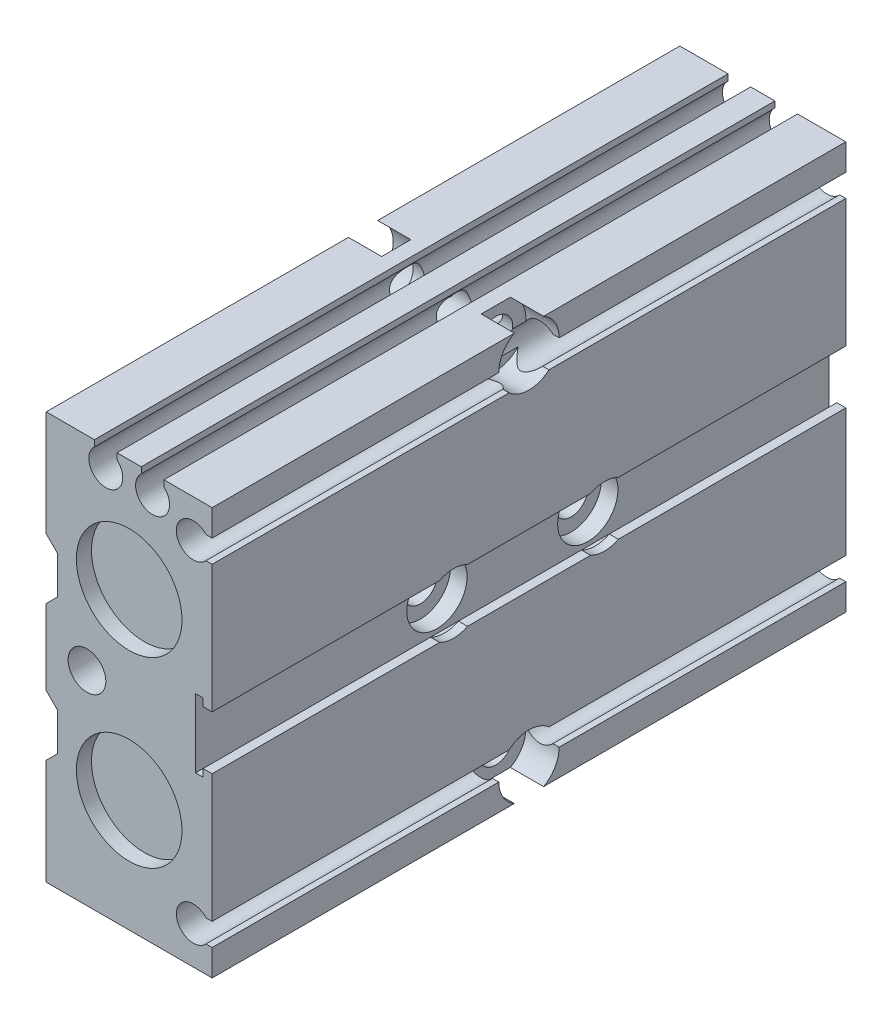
SolidWorks part; units mm, degrees
ref_plane "前视基准面" through (0, 0, 0) normal (0, 0, 1) x (1, 0, 0)
ref_plane "上视基准面" through (0, 0, 0) normal (0, 1, 0) x (1, 0, 0)
ref_plane "右视基准面" through (0, 0, 0) normal (1, 0, 0) x (0, 0, -1)
imported_body "输入1"
sketch "草图1" plane through (-11, 0, 0) normal (-1, 0, 0) x (0, 0, 1)
  line L1 (47, 27) -> (-3.9589, 27)
  line L2 (47, 27) -> (47, -28.3404)
  line L3 (47, -28.3404) -> (-3.9589, -28.3404)
  line L4 (-3.9589, 27) -> (-3.9589, -28.3404)
extrude "切除-拉伸1" cut sketch "草图1" against normal through all
